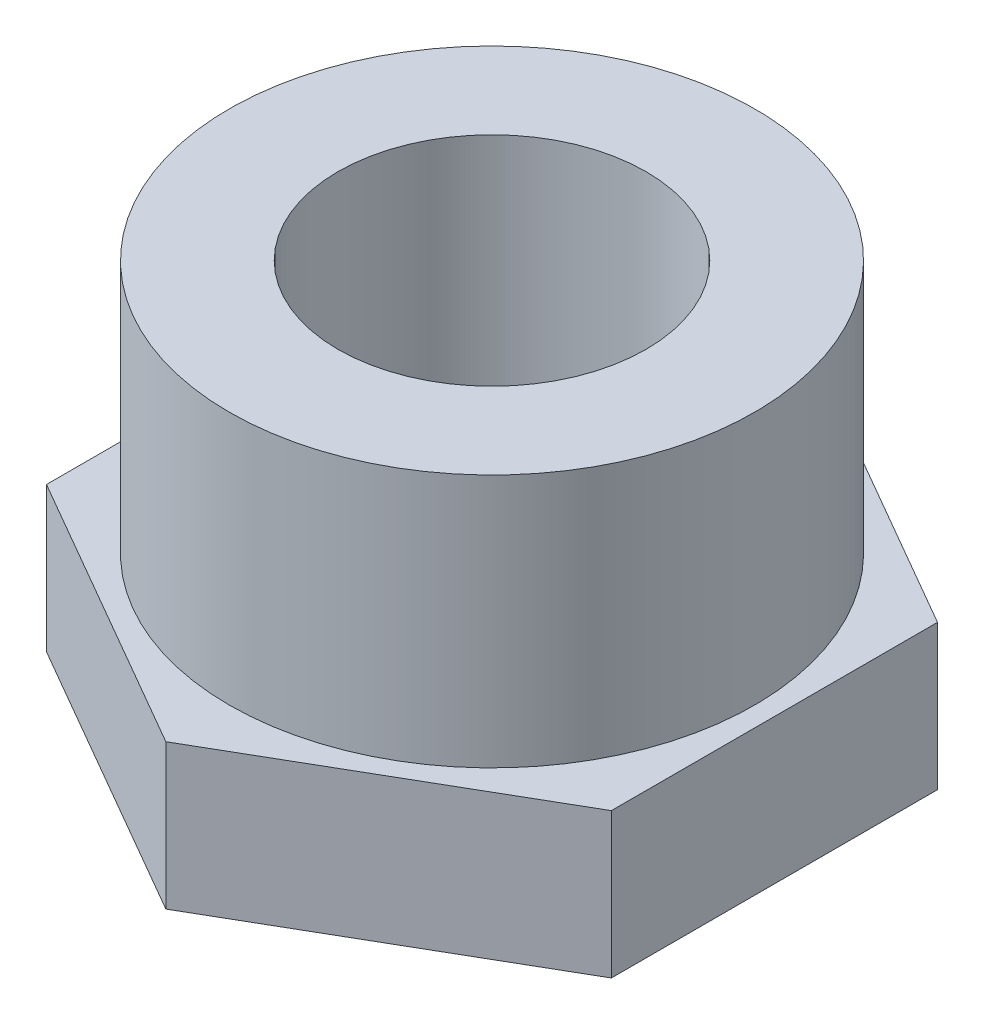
SolidWorks part; units mm, degrees
ref_plane "Front Plane" through (0, 0, 0) normal (0, 0, 1) x (1, 0, 0)
ref_plane "Top Plane" through (0, 0, 0) normal (0, 1, 0) x (1, 0, 0)
ref_plane "Right Plane" through (0, 0, 0) normal (1, 0, 0) x (0, 0, -1)
sketch "Sketch1" plane through (0, 0, 0) normal (0, 1, 0) x (1, 0, 0)
  line L1 (0, 22.86) -> (-19.7973, 11.43)
  line L2 (-19.7973, 11.43) -> (-19.7973, -11.43)
  line L3 (-19.7973, -11.43) -> (0, -22.86)
  line L4 (0, -22.86) -> (19.7973, -11.43)
  line L5 (19.7973, -11.43) -> (19.7973, 11.43)
  line L6 (19.7973, 11.43) -> (0, 22.86)
  circle A0 centre (0, 0) radius 19.7973 construction
  circle A1 centre (0, 0) radius 10.795
  dimension "D2" = 21.59
  dimension "D1" = 22.86
extrude "Boss-Extrude2" add sketch "Sketch1" along normal blind 10.16
sketch "Sketch2" plane through (0, 10.16, 0) normal (0, 1, 0) x (1, 0, 0)
  circle A0 centre (0, 0) radius 10.795
  circle A1 centre (0, 0) radius 10.795 construction
  circle A2 centre (0, 0) radius 18.415
  dimension "D1" = 36.83
extrude "Boss-Extrude3" add sketch "Sketch2" along normal blind 17.78
